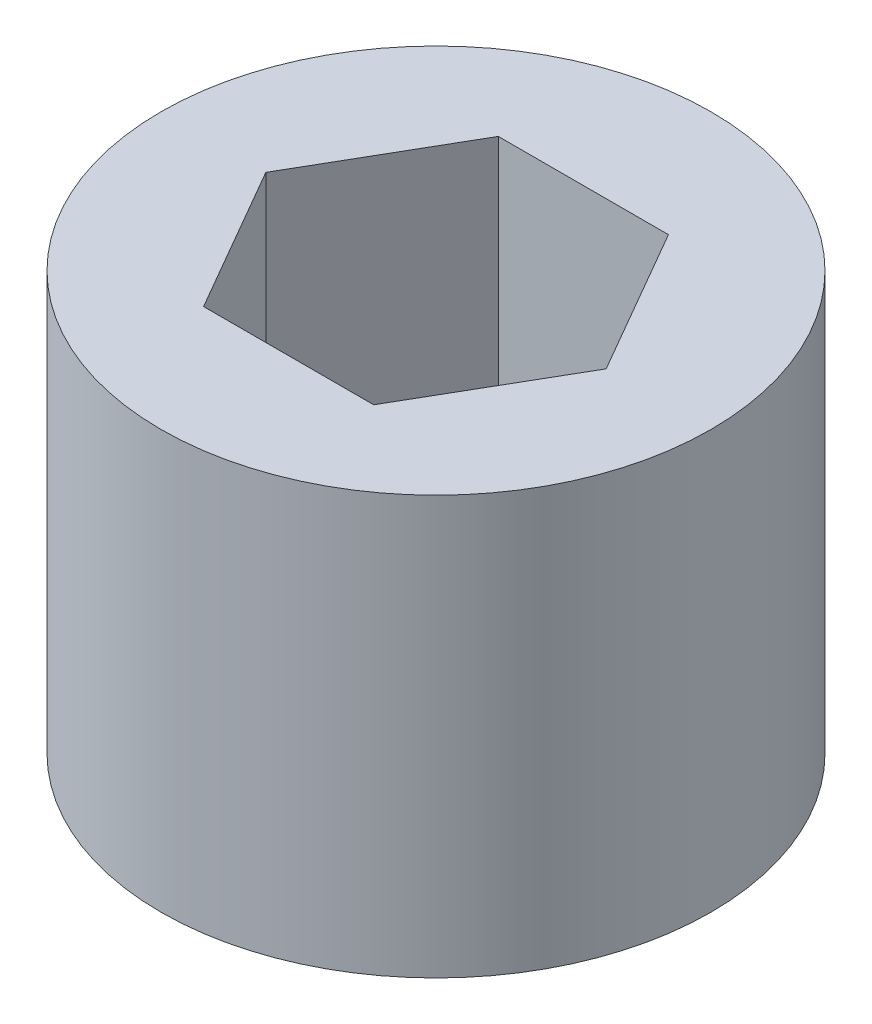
SolidWorks part; units mm, degrees
ref_plane "Front Plane" through (0, 0, 0) normal (0, 0, 1) x (1, 0, 0)
ref_plane "Top Plane" through (0, 0, 0) normal (0, 1, 0) x (1, 0, 0)
ref_plane "Right Plane" through (0, 0, 0) normal (1, 0, 0) x (0, 0, -1)
sketch "Sketch1" plane through (0, 0, 0) normal (0, 1, 0) x (1, 0, 0)
  circle A0 centre (0, 0) radius 4.445
  dimension "D1" = 8.89
extrude "Extrude1" add sketch "Sketch1" along normal blind 6.7564
sketch "Sketch2" plane through (0, 6.7564, 0) normal (0, 1, 0) x (1, 0, 0)
  line L0 (-3.175, -3.175) -> (3.175, 3.175) construction
  line L1 (-2.54, 3.175) -> (2.54, 3.175)
  line L2 (-3.175, 2.54) -> (-3.175, -2.54)
  line L3 (-2.54, -3.175) -> (2.54, -3.175)
  line L4 (3.175, 2.54) -> (3.175, -2.54)
  arc A0 (-2.54, 3.175) -> (-3.175, 2.54) centre (-2.54, 2.54) ccw
  arc A1 (2.54, 3.175) -> (3.175, 2.54) centre (2.54, 2.54) cw
  arc A2 (-3.175, -2.54) -> (-2.54, -3.175) centre (-2.54, -2.54) ccw
  arc A3 (2.54, -3.175) -> (3.175, -2.54) centre (2.54, -2.54) ccw
  point P15 (3.175, -3.175)
  dimension "D2" = 0.635
  dimension "D1" = 6.35
extrude "Extrude2" [suppressed] add sketch "Sketch2" along normal blind 4.7625
sketch "Sketch3" plane through (0, 6.7564, 0) normal (0, 1, 0) x (1, 0, 0)
  line L1 (1.3748, -2.3812) -> (2.7496, 0)
  line L2 (2.7496, 0) -> (1.3748, 2.3813)
  line L3 (1.3748, 2.3813) -> (-1.3748, 2.3813)
  line L4 (-1.3748, 2.3813) -> (-2.7496, 0)
  line L5 (-2.7496, 0) -> (-1.3748, -2.3812)
  line L6 (-1.3748, -2.3812) -> (1.3748, -2.3812)
  circle A0 centre (0, 0) radius 2.3812 construction
  dimension "D1" = 4.7625
extrude "Extrude3" cut sketch "Sketch3" against normal blind 4.7752
